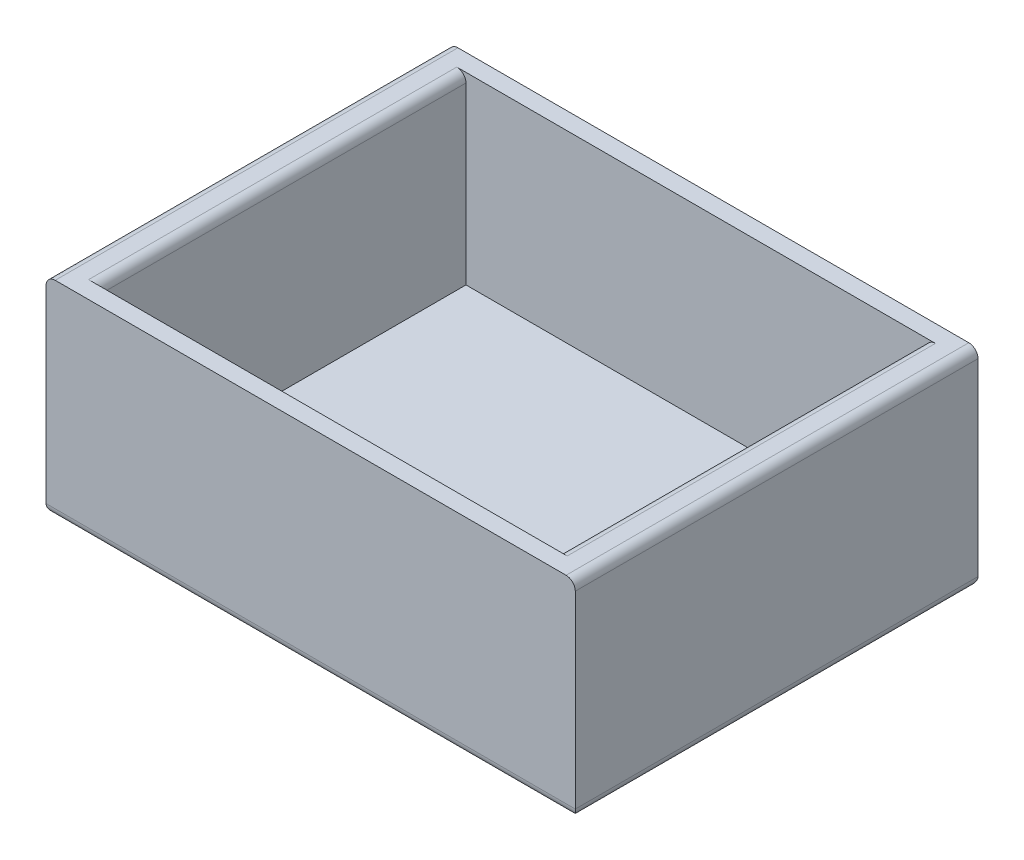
SolidWorks part; units mm, degrees
ref_plane "Front Plane" through (0, 0, 0) normal (0, 0, 1) x (1, 0, 0)
ref_plane "Top Plane" through (0, 0, 0) normal (0, 1, 0) x (1, 0, 0)
ref_plane "Right Plane" through (0, 0, 0) normal (1, 0, 0) x (0, 0, -1)
sketch "Sketch1" plane through (0, 0, 0) normal (0, 1, 0) x (1, 0, 0)
  line L1 (-73.025, 55.5625) -> (73.025, 55.5625)
  line L2 (-73.025, 55.5625) -> (-73.025, -55.5625)
  line L3 (-73.025, -55.5625) -> (73.025, -55.5625)
  line L4 (73.025, 55.5625) -> (73.025, -55.5625)
  line L5 (-73.025, 55.5625) -> (73.025, -55.5625) construction
  line L6 (-73.025, -55.5625) -> (73.025, 55.5625) construction
  point P0 (0, 0)
  dimension "D1" = 111.125
  dimension "D2" = 146.05
extrude "Boss-Extrude1" add sketch "Sketch1" along normal blind 57.15
sketch "Sketch2" plane through (0, 57.15, 0) normal (0, 1, 0) x (1, 0, 0)
  line L1 (-63.5, 50.8) -> (63.5, 50.8)
  line L2 (-63.5, 50.8) -> (-63.5, -50.8)
  line L3 (-63.5, -50.8) -> (63.5, -50.8)
  line L4 (63.5, 50.8) -> (63.5, -50.8)
  line L5 (-63.5, 50.8) -> (63.5, -50.8) construction
  line L6 (-63.5, -50.8) -> (63.5, 50.8) construction
  point P0 (0, 0)
  dimension "D1" = 127
  dimension "D2" = 101.6
extrude "Cut-Extrude1" cut sketch "Sketch2" against normal blind 50.8
fillet "Fillet1" radius 2.54 8 edges at (0, 0, -55.5625) (0, 0, 55.5625) (73.025, 0, 0) (-73.025, 0, 0) (-73.025, 57.15, 0) (73.025, 57.15, 0) (63.5, 57.15, 0) (-63.5, 57.15, 0)
